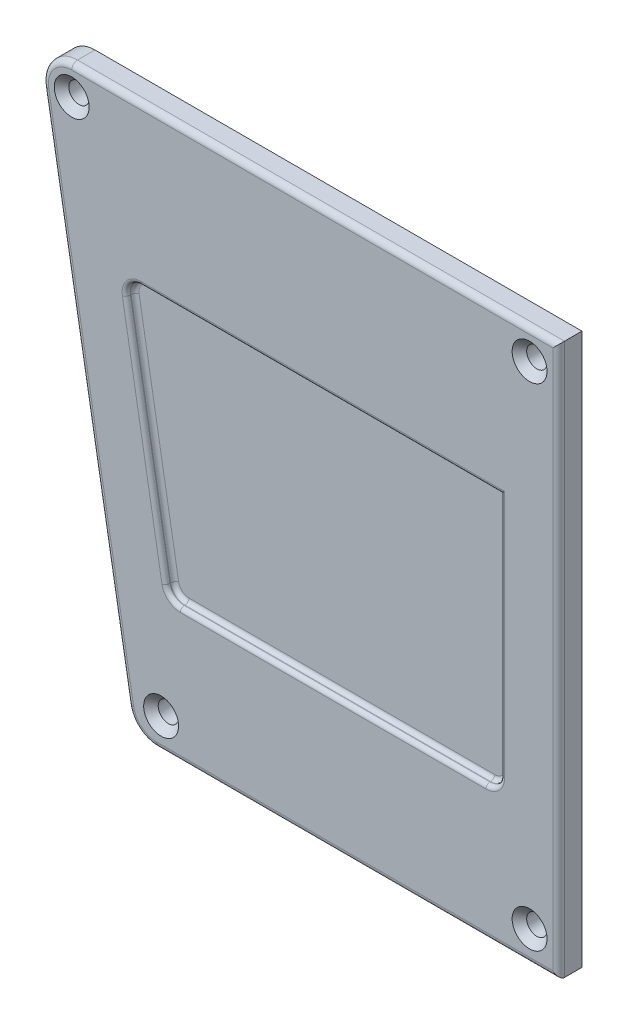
SolidWorks part; units mm, degrees
ref_plane "Plan1" through (0, 0, 0) normal (0, 0, 1) x (1, 0, 0)
ref_plane "Plan2" through (0, 0, 0) normal (0, 1, 0) x (1, 0, 0)
ref_plane "Plan3" through (0, 0, 0) normal (1, 0, 0) x (0, 0, -1)
sketch "Esquisse1" plane through (0, 0, 0) normal (0, 0, 1) x (1, 0, 0)
  line L0 (23.3336, -2) -> (-114.8909, -2)
  line L1 (-124.7459, 6.3033) -> (-153.9114, 175.7033)
  line L2 (-144.0564, 187.4) -> (23.3336, 187.4)
  line L3 (23.3336, 187.4) -> (23.3336, -2)
  line L4 (13.3336, 210) -> (13.3336, -30) construction
  line L5 (-22.4886, 177.4) -> (66.5647, 177.4) construction
  line L6 (-153.8952, 8.49) -> (56.474, 8.49) construction
  line L7 (-113.3164, 50.49) -> (-113.3164, -29.51) construction
  arc A0 (-144.0564, 187.4) -> (-153.9114, 175.7033) centre (-144.0564, 177.4) ccw
  circle A1 centre (13.3336, 8.49) radius 3.5
  circle A2 centre (-144.0564, 177.4) radius 3.5
  circle A3 centre (-113.3164, 8.49) radius 3.5
  circle A4 centre (13.3336, 177.4) radius 3.5
  arc A5 (-114.8909, -2) -> (-124.7459, 6.3033) centre (-114.8909, 8) cw
  point P23 (-123.3164, -2)
  dimension "D4" = 168.91
  dimension "D5" = 20
  dimension "D6" = 10
  dimension "D7" = 7
  dimension "D3" = 167.39
  dimension "D8" = 7
  dimension "D9" = 7
  dimension "D10" = 7
  dimension "D11" = 126.65
  dimension "D12" = 10
  dimension "D1" = 189.4
  dimension "D2" = 10
extrude "Base-Extrusion" add sketch "Esquisse1" along normal blind 8
fillet "Congé1" radius 2 6 edges at (-45.7786, -2, 8) (-121.3342, 0.3525, 8) (-139.3286, 91.0033, 8) (-151.7038, 183.8433, 8) (23.3336, 92.7, 8) (-60.3614, 187.4, 8)
sketch "Esquisse2" plane through (0, 0, 8) normal (0, 0, 1) x (1, 0, 0)
  line L0 (-106.7292, 44) -> (-1.6664, 44)
  line L1 (23.3336, -2) -> (-114.8909, -2) construction
  line L2 (-120.3305, 133) -> (3.3336, 133)
  line L3 (3.3336, 49) -> (3.3336, 133)
  line L4 (-125.258, 127.1516) -> (-111.6567, 48.1516)
  line L5 (-151.9404, 176.0426) -> (-122.7749, 6.6426) construction
  line L6 (-124.7459, 6.3033) -> (-153.9114, 175.7033) construction
  line L7 (23.3336, 187.4) -> (23.3336, -2) construction
  arc A0 (-125.258, 127.1516) -> (-120.3305, 133) centre (-120.3305, 128) cw
  arc A1 (-106.7292, 44) -> (-111.6567, 48.1516) centre (-106.7292, 49) cw
  arc A2 (3.3336, 49) -> (-1.6664, 44) centre (-1.6664, 49) cw
  dimension "D5" = 5
  dimension "D1" = 46
  dimension "D2" = 135
  dimension "D3" = 20
  dimension "D4" = 20
extrude "Enlèv. mat.-Extru.1" cut sketch "Esquisse2" against normal blind 3
fillet "Congé2" radius 1.4 14 edges at (-58.4984, 133, 8) (-124.1542, 131.2217, 8) (3.3336, 91, 8) (1.8692, 45.4645, 8) (-54.1978, 44, 8) (-109.9508, 45.1763, 8) (1.8692, 45.4645, 5) (-54.1978, 44, 5) (-109.9508, 45.1763, 5) (-118.4573, 87.6516, 5) (-124.1542, 131.2217, 5) (-58.4984, 133, 5) (3.3336, 91, 5) (-118.4573, 87.6516, 8)
sketch "Esquisse3" plane through (0, 0, 0) normal (0, 0, -1) x (-1, 0, 0)
  line L0 (120.3305, 133) -> (-3.3336, 133) construction
  line L1 (1.6664, 37) -> (96.9518, 37)
  line L2 (-3.3336, 32) -> (-3.3336, 14.4331)
  line L3 (1.6664, 9.4331) -> (96.9518, 9.4331)
  line L4 (101.9518, 32) -> (101.9518, 14.4331)
  line L5 (1.6664, 167.5483) -> (121.5247, 167.5483)
  line L6 (-3.3336, 162.5483) -> (-3.3336, 145)
  line L7 (1.6664, 140) -> (121.5247, 140)
  line L8 (126.5247, 162.5483) -> (126.5247, 145)
  line L9 (1.6664, 44) -> (106.7292, 44) construction
  line L10 (-3.3336, 133) -> (-3.3336, 49) construction
  arc A0 (121.5247, 167.5483) -> (126.5247, 162.5483) centre (121.5247, 162.5483) cw
  arc A1 (-3.3336, 162.5483) -> (1.6664, 167.5483) centre (1.6664, 162.5483) cw
  arc A2 (1.6664, 140) -> (-3.3336, 145) centre (1.6664, 145) cw
  arc A3 (126.5247, 145) -> (121.5247, 140) centre (121.5247, 145) cw
  arc A4 (96.9518, 37) -> (101.9518, 32) centre (96.9518, 32) cw
  arc A5 (-3.3336, 32) -> (1.6664, 37) centre (1.6664, 32) cw
  arc A6 (1.6664, 9.4331) -> (-3.3336, 14.4331) centre (1.6664, 14.4331) cw
  arc A7 (101.9518, 14.4331) -> (96.9518, 9.4331) centre (96.9518, 14.4331) cw
  dimension "D3" = 5
  dimension "D1" = 7
  dimension "D2" = 7
extrude "Enlèv. mat.-Extru.2" cut sketch "Esquisse3" against normal blind 3
fillet "Congé3" radius 2 16 edges at (-101.9518, 23.2166, 3) (-100.4874, 10.8976, 3) (-49.3091, 9.4331, 3) (1.8692, 10.8976, 3) (3.3336, 23.2166, 3) (1.8692, 35.5355, 3) (-49.3091, 37, 3) (-100.4874, 35.5355, 3) (-126.5247, 153.7741, 3) (-125.0602, 141.4645, 3) (-61.5955, 140, 3) (1.8692, 141.4645, 3) (3.3336, 153.7741, 3) (1.8692, 166.0838, 3) (-61.5955, 167.5483, 3) (-125.0602, 166.0838, 3)
sketch "Esquisse4" plane through (0, 0, 8) normal (0, 0, 1) x (1, 0, 0)
  circle A0 centre (-144.0564, 177.4) radius 6
  circle A1 centre (13.3336, 177.4) radius 6
  circle A2 centre (13.3336, 8.49) radius 6
  circle A3 centre (-113.3164, 8.49) radius 6
  dimension "D1" = 12
  dimension "D2" = 12
  dimension "D3" = 12
  dimension "D4" = 12
extrude "Enlèv. mat.-Extru.3" cut sketch "Esquisse4" against normal blind 3 draft 45
